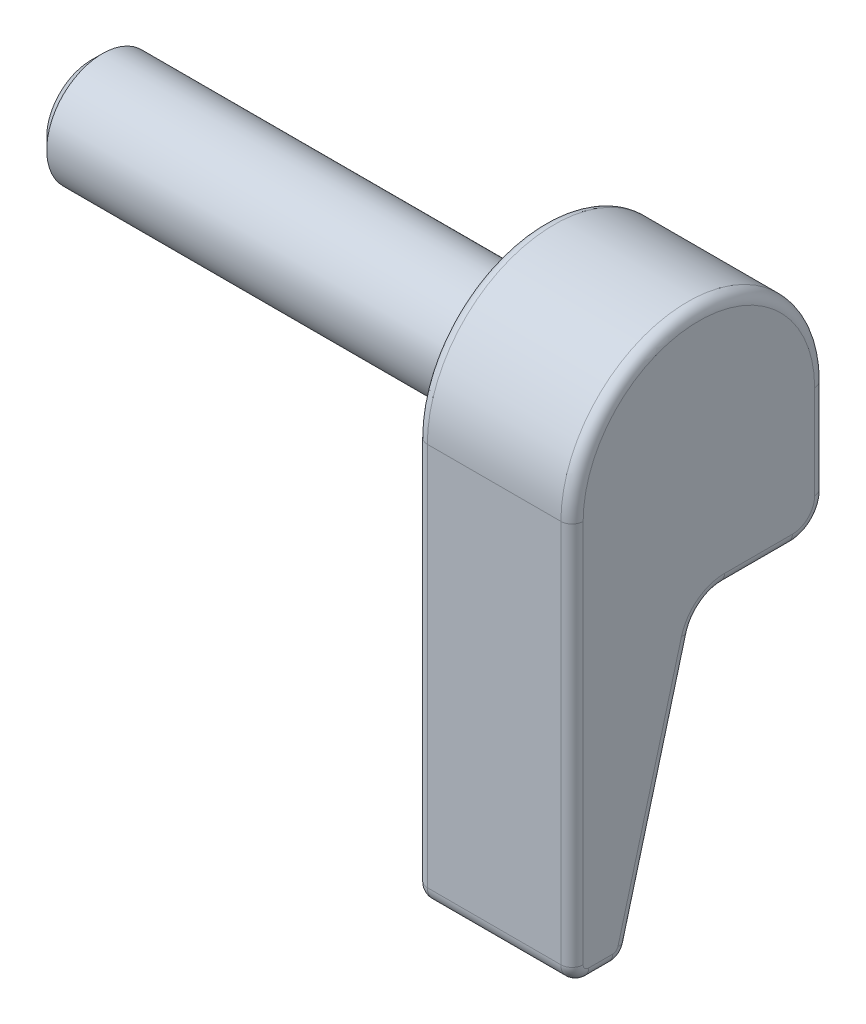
SolidWorks part; units mm, degrees
ref_plane "Спереди" through (0, 0, 0) normal (0, 0, 1) x (1, 0, 0)
ref_plane "Сверху" through (0, 0, 0) normal (0, 1, 0) x (1, 0, 0)
ref_plane "Справа" through (0, 0, 0) normal (1, 0, 0) x (0, 0, -1)
sketch "Эскиз1" plane through (0, 0, 0) normal (1, 0, 0) x (0, 0, -1)
  circle A0 centre (0, 0) radius 5
  dimension "D1" = 10
extrude "Бобышка-Вытянуть1" add sketch "Эскиз1" along normal blind 40
sketch "Эскиз2" plane through (40, 0, 0) normal (1, 0, 0) x (0, 0, -1)
  line L5 (0.6, 13.9355) -> (0.6, -28.5021) construction
  line L6 (-9.3, -36) -> (-7.1506, -36)
  line L7 (-10.8, 0) -> (-10.8, -34.5)
  line L8 (-5.7018, -34.8887) -> (0.0037, -13.6226)
  line L9 (2.9012, -11.4) -> (9, -11.4)
  line L10 (12, -8.4) -> (12, 0)
  arc A0 (12, 0) -> (-10.8, 0) centre (0.6, 0) ccw
  arc A5 (-10.8, -34.5) -> (-9.3, -36) centre (-9.3, -34.5) ccw
  arc A6 (-7.1506, -36) -> (-5.7018, -34.8887) centre (-7.1506, -34.5) ccw
  arc A7 (0.0037, -13.6226) -> (2.9012, -11.4) centre (2.9012, -14.4) cw
  arc A8 (9, -11.4) -> (12, -8.4) centre (9, -8.4) ccw
  point P15 (5.4, -36)
  point P18 (10.2, -36)
  dimension "D1" = 22.8
  dimension "D5" = 36
  dimension "D6" = 1.5
  dimension "D7" = 1.5
  dimension "D9" = 3
  dimension "D10" = 3
  dimension "D2" = 12
  dimension "D3" = 22.8
  dimension "D4" = 4.8
  dimension "D8" = 11.4
  dimension "D11" = 3.6494
  dimension "D12" = 15.018
extrude "Бобышка-Вытянуть2" add sketch "Эскиз2" along normal blind 14
fillet "Скругление1" radius 1 20 edges at (40, 11.4, -0.6) (54, 11.4, -0.6) (54, -4.2, -12) (54, -10.5213, -11.1213) (54, -11.4, -5.9506) (54, -12.0196, -1.0753) (54, -24.2557, 2.8491) (54, -35.6902, 6.2377) (54, -36, 8.2253) (54, -35.5607, 10.3607) (54, -17.25, 10.8) (40, -4.2, -12) (40, -10.5213, -11.1213) (40, -11.4, -5.9506) (40, -12.0196, -1.0753) (40, -24.2557, 2.8491) (40, -35.6902, 6.2377) (40, -36, 8.2253) (40, -35.5607, 10.3607) (40, -17.25, 10.8)
chamfer "Фаска1" distance 1 angle 45 1 edges at (0, 0, -5)
chamfer "Фаска2" distance 0.25 angle 45 1 edges at (40, 0, -5)
